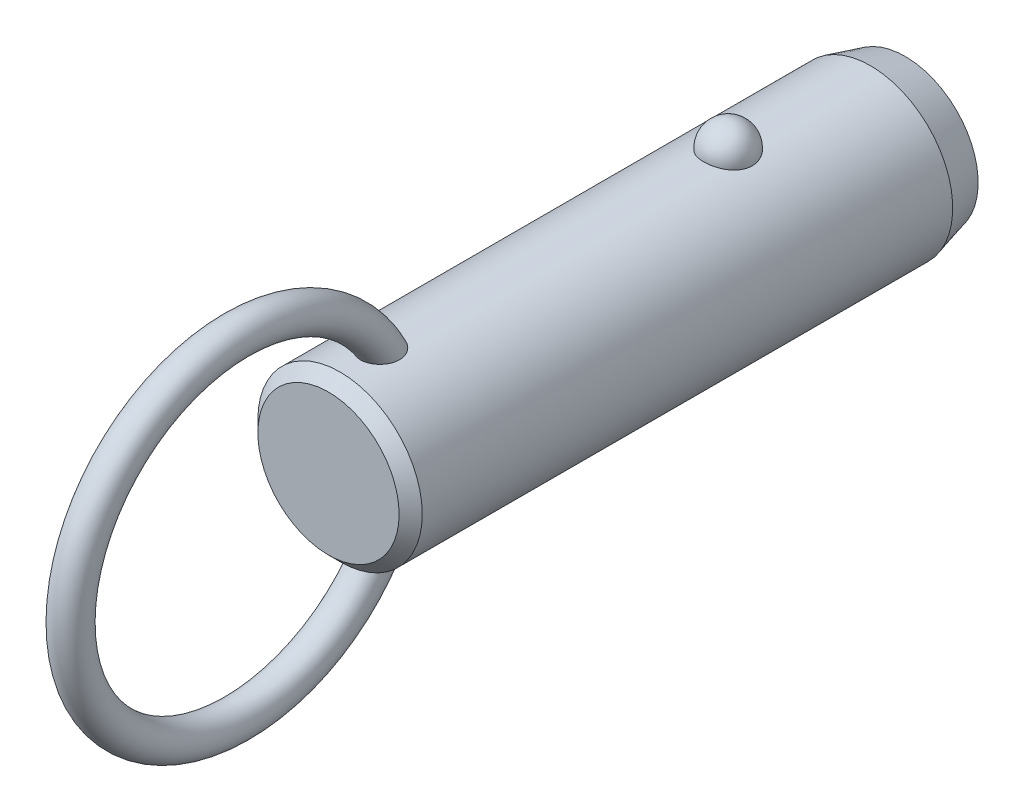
SolidWorks part; units mm, degrees
ref_plane "Front Plane" through (0, 0, 0) normal (0, 0, 1) x (1, 0, 0)
ref_plane "Top Plane" through (0, 0, 0) normal (0, 1, 0) x (1, 0, 0)
ref_plane "Right Plane" through (0, 0, 0) normal (1, 0, 0) x (0, 0, -1)
sketch "Sketch2" plane through (0, 0, 0) normal (0, 0, 1) x (1, 0, 0)
  circle A0 centre (0, 0) radius 7.1
  point P3 (0, 7.1)
  dimension "D1" = 14.2
extrude "Boss-Extrude1" add sketch "Sketch2" along normal blind 24.5
sketch "Sketch3" plane through (0, 0, 0) normal (0, 0, -1) x (-1, 0, 0)
  circle A0 centre (0, 0) radius 7.1
  dimension "D1" = 14.2
extrude "Boss-Extrude2" add sketch "Sketch3" along normal blind 17.4
chamfer "Chamfer1" distance 3 angle 15 1 edges at (-7.1, 0, -17.4)
sketch "Sketch12" plane through (0, 0, 0) normal (1, 0, 0) x (0, 0, -1)
  line L0 (-24.5, 7.1) -> (-24.5, -7.1) construction
  point P0 (-24.5, 0)
sketch "Sketch13" plane through (0, 0, 0) normal (1, 0, 0) x (0, 0, -1)
  circle A0 centre (-40.35, 0) radius 15.85
  point P2 (-24.5, 0)
  dimension "D1" = 31.7
sketch "Sketch14" plane through (0, 0, 0) normal (0, 1, 0) x (1, 0, 0)
  circle A0 centre (0, -26) radius 1.5
  point P2 (0, -24.5)
  dimension "D1" = 3
sweep "Sweep1" add profiles "Sketch14" path "Sketch13"
sketch "Sketch15" plane through (0, 0, 24.5) normal (0, 0, 1) x (1, 0, 0)
  circle A0 centre (0, 0) radius 7.1
  dimension "D1" = 14.2
extrude "Boss-Extrude3" add sketch "Sketch15" along normal blind 7.92
chamfer "Chamfer2" distance 1 angle 45 1 edges at (7.1, 0, 32.42)
sketch "Sketch18" plane through (0, 0, 0) normal (1, 0, 0) x (0, 0, -1)
  line L0 (14.4, 7.1) -> (-26.1792, 7.1) construction
  line L1 (2.1, 9.2) -> (2.1, 5)
  line L2 (-26.1792, -7.1) -> (14.4, -7.1) construction
  arc A0 (2.1, 9.2) -> (2.1, 5) centre (2.1, 7.1) ccw
  point P4 (0, 7.1)
  dimension "D1" = 16.3
revolve "Revolve1" add sketch "Sketch18" angle 360 about L1
